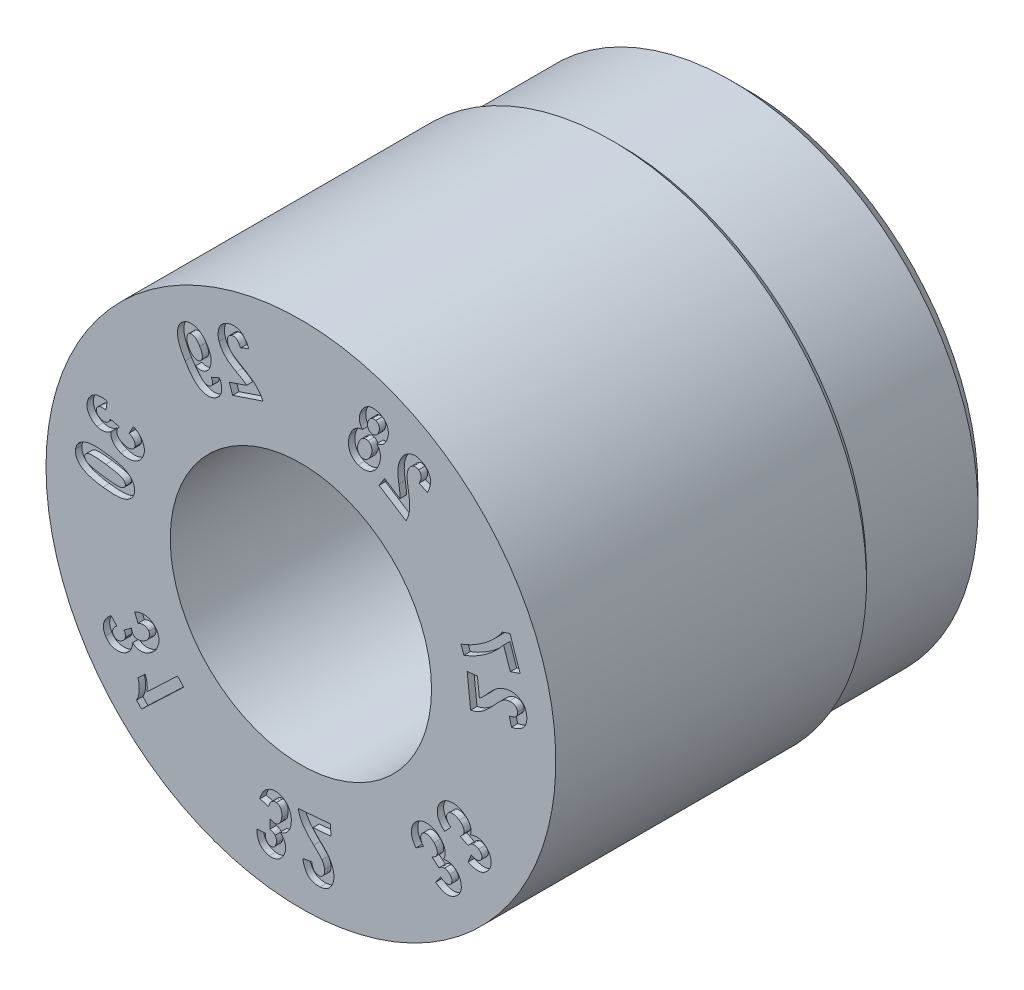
SolidWorks part; units mm, degrees
ref_plane "Front Plane" through (0, 0, 0) normal (0, 0, 1) x (1, 0, 0)
ref_plane "Top Plane" through (0, 0, 0) normal (0, 1, 0) x (1, 0, 0)
ref_plane "Right Plane" through (0, 0, 0) normal (1, 0, 0) x (0, 0, -1)
sketch "Sketch2" plane through (0, 0, 0) normal (0, 1, 0) x (1, 0, 0)
  line L0 (0, 4.8491) -> (0, -49995.1509) construction
  line L10 (7.2496, 14) -> (2, 14)
  line L11 (7.75, 13.4996) -> (7.2496, 14)
  line L12 (7.75, 10) -> (7.75, 13.4996)
  line L13 (8, 9.75) -> (7.75, 10)
  line L14 (8, 0) -> (8, 9.75)
  line L15 (4.1, 0) -> (8, 0)
  line L16 (4.1, 0) -> (4.1, 10)
  line L17 (2, 10) -> (4.1, 10)
  line L18 (2, 10) -> (2, 14)
  dimension "D1" = 16
  dimension "D2" = 8.2
  dimension "D3" = 4
  dimension "D4" = 4
  dimension "D5" = 15.5
  dimension "D6" = 14
  dimension "D7" = 45
  dimension "D8" = 45
  dimension "D9" = 4
  dimension "D10" = 0.5004
revolve "Revolve1" add sketch "Sketch2" angle 360 about L0
sketch "Sketch9" plane through (0, 0, 0) normal (0, 0, 1) x (1, 0, 0)
  circle A30 centre (0, 0) radius 5.3324 construction
  text T0 "27    28    29    30    31    32    33" font "Arial Narrow" height 1.82
extrude "Cut-Extrude3" cut sketch "Sketch9" against normal blind 0.2
